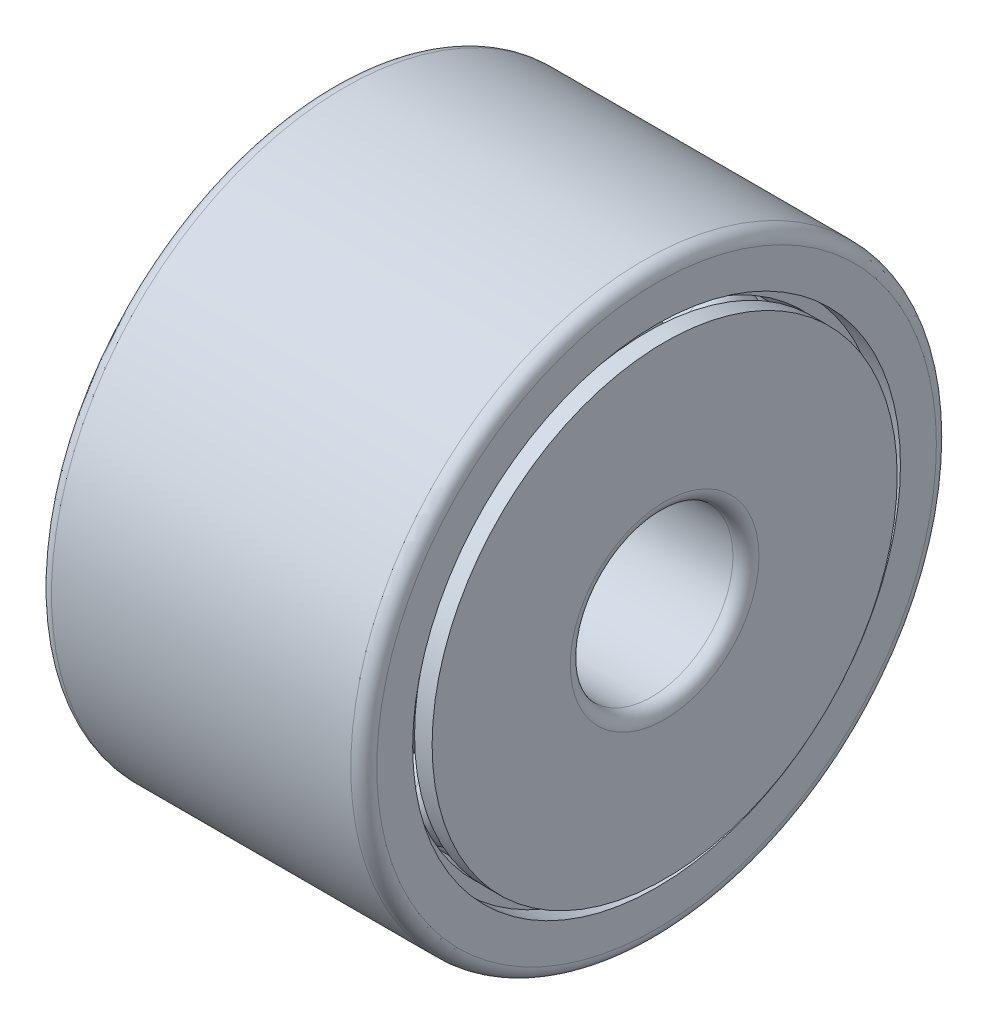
SolidWorks part; units mm, degrees
ref_plane "Plane1" through (0, 0, 0) normal (0, 0, 1) x (1, 0, 0)
ref_plane "Plane2" through (0, 0, 0) normal (0, 1, 0) x (1, 0, 0)
ref_plane "Plane3" through (0, 0, 0) normal (1, 0, 0) x (0, 0, -1)
sketch "Clipboard" plane through (0, 0, 0) normal (0, 0, 1) x (1, 0, 0)
  line L0 (-10, 0) -> (10, 0) construction
  line L1 (0, 0) -> (27.0344, -5.7463)
  line L2 (0, 0) -> (22.4793, 28.7722)
  line L3 (0, 0) -> (27.9428, -35.7651)
  line L4 (0, 0) -> (-22.3471, -0.7804)
  dimension "CLdia" = 36.5125
  dimension "Count" = 52
  dimension "Show_count" = 52
  dimension "Max_count" = 12
  dimension "Min_count" = 2
  dimension "Race_OD" = 45.3866
  dimension "Race_ID" = 27.6384
sketch "OutRacSke" plane through (0, 0, 0) normal (0, 0, 1) x (1, 0, 0)
  line L0 (-14.0229, 22.6933) -> (-14.0229, 23.8026)
  line L1 (-14.0229, 23.8026) -> (-15.875, 23.8026)
  line L2 (-15.875, 23.8026) -> (-15.875, 27.305)
  line L3 (-14.605, 28.575) -> (14.605, 28.575)
  line L4 (15.875, 27.305) -> (15.875, 23.8026)
  line L5 (15.875, 23.8026) -> (14.0229, 23.8026)
  line L6 (14.0229, 23.8026) -> (14.0229, 22.6933)
  line L7 (14.0229, 22.6933) -> (-14.0229, 22.6933)
  line L8 (-7.9375, 0) -> (7.9375, 0) construction
  arc A0 (-15.875, 27.305) -> (-14.605, 28.575) centre (-14.605, 27.305) cw
  arc A1 (14.605, 28.575) -> (15.875, 27.305) centre (14.605, 27.305) cw
  dimension "Radius" = 1.27
  dimension "D1" = 14.0229
  dimension "Race_OD" = 45.3866
  dimension "OD" = 57.15
  dimension "Cyl_Len" = 28.0458
  dimension "Width" = 31.75
  dimension "Groove_Dp" = 1.1093
  dimension "halfWidth" = 15.875
revolve "OuterRace" add sketch "OutRacSke" angle 360 about L8
sketch "RolDetSke" plane through (0, 0, 0) normal (0, 0, 1) x (1, 0, 0)
  line L0 (-14.0229, 20.9188) -> (-14.0229, 18.2562)
  line L1 (-14.0229, 18.2562) -> (14.0229, 18.2562)
  line L2 (14.0229, 18.2562) -> (14.0229, 20.9188)
  line L3 (12.2479, 22.6938) -> (-12.2479, 22.6938)
  line L4 (-28.575, 18.2562) -> (28.575, 18.2562) construction
  arc A0 (14.0229, 20.9188) -> (12.2479, 22.6938) centre (12.2479, 20.9188) ccw
  arc A1 (-12.2479, 22.6938) -> (-14.0229, 20.9188) centre (-12.2479, 20.9188) ccw
  dimension "radius" = 1.775
  dimension "CLRad" = 18.2562
  dimension "Roller_diameter" = 8.8751
  dimension "Cyl_Len" = 28.0458
  dimension "halfCylLen" = 14.0229
revolve "RollerDetailed" add sketch "RolDetSke" angle 360 about L4
ref_axis "Axis1" through (-50, 0, 0) along (1, 0, 0)
pattern_circular "RollersDetailed" count 12 every 30 about axis through (-50, 0, 0) along (1, 0, 0) of "RollerDetailed", "OuterRace"
sketch "RolSimSke" plane through (0, 25.4, 0) normal (0, 0, 1) x (1, 0, 0)
  line L0 (-14.0229, -4.4807) -> (-14.0229, -9.8058)
  line L1 (-25.4, -25.4) -> (25.4, -25.4) construction
  line L2 (14.0229, -9.8058) -> (14.0229, -4.4807)
  line L3 (12.2479, -2.7057) -> (-12.2479, -2.7057)
  line L5 (12.2479, -11.5808) -> (-12.2479, -11.5808)
  arc A0 (14.0229, -4.4807) -> (12.2479, -2.7057) centre (12.2479, -4.4807) ccw
  arc A1 (-12.2479, -2.7057) -> (-14.0229, -4.4807) centre (-12.2479, -4.4807) ccw
  arc A2 (14.0229, -9.8058) -> (12.2479, -11.5808) centre (12.2479, -9.8058) cw
  arc A3 (-12.2479, -11.5808) -> (-14.0229, -9.8058) centre (-12.2479, -9.8058) cw
  dimension "radius" = 1.775
  dimension "Bore" = 27.6384
  dimension "Roller_diameter" = 8.8751
  dimension "Cyl_Len" = 28.0458
  dimension "halfLength" = 14.0229
revolve "RollersSimplified" [suppressed] add sketch "RolSimSke" angle 360 about L1
sketch "InsRacSke" plane through (0, 0, 0) normal (0, 0, 1) x (1, 0, 0)
  line L0 (-14.949, 13.8192) -> (-14.949, 22.6933)
  line L1 (-14.949, 22.6933) -> (-16.6624, 22.6933)
  line L2 (-16.6624, 22.6933) -> (-16.6624, 9.2075)
  line L3 (-15.3924, 7.9375) -> (-0.84, 7.9375)
  line L4 (0.84, 7.9375) -> (15.3924, 7.9375)
  line L5 (16.6624, 9.2075) -> (16.6624, 22.6933)
  line L6 (16.6624, 22.6933) -> (14.949, 22.6933)
  line L7 (14.949, 22.6933) -> (14.949, 13.8192)
  line L8 (14.949, 13.8192) -> (-14.949, 13.8192)
  line L9 (-7.9375, 0) -> (7.9375, 0) construction
  arc A0 (-16.6624, 9.2075) -> (-15.3924, 7.9375) centre (-15.3924, 9.2075) ccw
  arc A1 (-0.84, 7.9375) -> (0.84, 7.9375) centre (0, 6.985) cw
  arc A2 (15.3924, 7.9375) -> (16.6624, 9.2075) centre (15.3924, 9.2075) ccw
  dimension "radius" = 1.27
  dimension "Bore" = 15.875
  dimension "Width_IR" = 33.3248
  dimension "halfWidth" = 16.6624
  dimension "SlotWidth" = 29.8979
  dimension "Race_OD" = 45.3866
  dimension "Race_ID" = 27.6384
  dimension "offset" = 0.9525
  dimension "halfSlotWidth" = 14.949
revolve "InnerRace" add sketch "InsRacSke" angle 360 about L9
equation "\"halfWidth@OutRacSke\" =  \"Width@OutRacSke\" / 2"
equation "\"CLdia@Clipboard\" =  ( \"Race_OD@Clipboard\" + \"Race_ID@Clipboard\" )  / 2"
equation "\"CLRad@RolDetSke\" = ( \"Race_OD@Clipboard\" + \"Race_ID@Clipboard\" )  / 4"
equation "\"Roller_diameter@RolDetSke\" =  ( \"Race_OD@Clipboard\" -  \"Race_ID@Clipboard\" )  / 2 + .001"
equation "\"Roller_diameter@RolSimSke\" = ( \"Race_OD@Clipboard\" -  \"Race_ID@Clipboard\" )  / 2 + .001"
equation "\"radius@RolDetSke\" = \"Roller_diameter@RolDetSke\" / 5"
equation "\"radius@RolSimSke\" = \"Roller_diameter@RolSimSke\" / 5"
equation "\"Cyl_Len@OutRacSke\" = \"Cyl_Len@RolDetSke\""
equation "\"Cyl_Len@RolSimSke\" = \"Cyl_Len@RolDetSke\""
equation "\"halfCylLen@RolDetSke\" = \"Cyl_Len@RolDetSke\" / 2"
equation "\"offset@InsRacSke\" = \"radius@InsRacSke\" * 0.75"
equation "\"SlotWidth@InsRacSke\" =  ( \"Width@OutRacSke\" + \"Cyl_Len@RolDetSke\" )  / 2"
equation "\"halfSlotWidth@InsRacSke\" = \"SlotWidth@InsRacSke\" / 2"
equation "\"D1@OutRacSke\" = \"Cyl_Len@OutRacSke\" / 2"
equation "\"Max_count@Clipboard\" = int( 3.14159265 / atn(( \"Roller_diameter@RolDetSke\" / 2) / sqr( \"CLRad@RolDetSke\"  *  \"CLRad@RolDetSke\" - ( \"Roller_diameter@RolDetSke\" / 2) *  ( \"Roller_diameter@RolDetSke\" / "
equation "\"Max_count@Clipboard\" = ((sgn( \"Max_count@Clipboard\" - \"Count@Clipboard\" )-1)*( \"Max_count@Clipboard\" - \"Count@Clipboard\" ))/-2+ \"Count@Clipboard\""
equation "\"Count@RollersDetailed\" = int( \"Show_count@Clipboard\" ) "
equation "\"Count@RollersDetailed\" = ((sgn( \"Count@RollersDetailed\" - \"Max_count@Clipboard\" )-1)*( \"Count@RollersDetailed\" - \"Max_count@Clipboard\" ))/-2+ \"Max_count@Clipboard\""
equation "\"Count@RollersDetailed\" = ((sgn( \"Count@RollersDetailed\" - \"Min_count@Clipboard\" )+1)*( \"Count@RollersDetailed\" - \"Min_count@Clipboard\"))/2 +\"Min_count@Clipboard\""
equation "\"Angle@RollersDetailed\" = 360.0 / \"Max_count@Clipboard\""
equation "\"Bore@RolSimSke\" = \"Race_ID@Clipboard\""
equation "\"Race_ID@InsRacSke\" = \"Race_ID@Clipboard\""
equation "\"Race_OD@InsRacSke\" = \"Race_OD@Clipboard\""
equation "\"halfWidth@InsRacSke\" = \"Width_IR@InsRacSke\" / 2"
equation "\"halfLength@RolSimSke\" = \"Cyl_Len@RolSimSke\" / 2"
equation "\"Race_OD@OutRacSke\" = \"Race_OD@Clipboard\""
